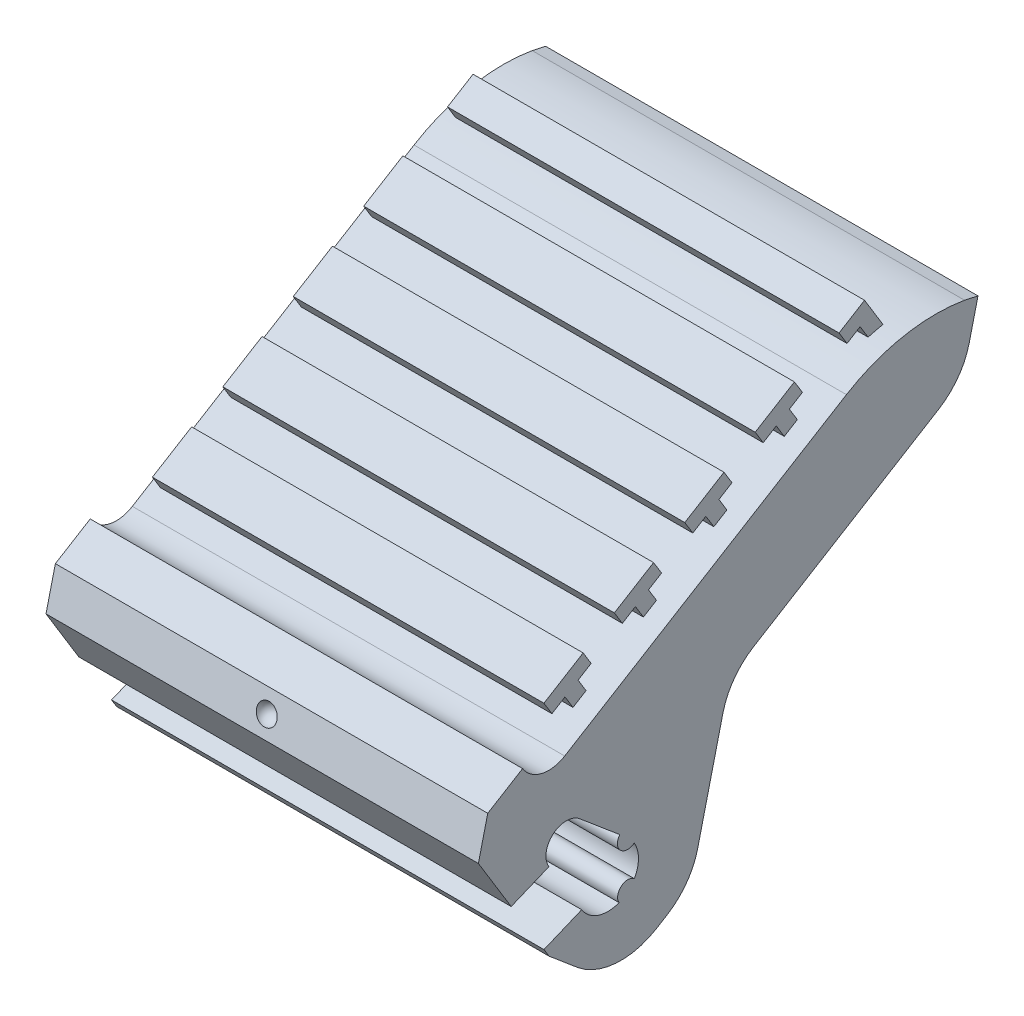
SolidWorks part; units mm, degrees
other "<finger_flexure_print>-<Pulley Cover Fillet>"
ref_plane "Front Plane" through (0, 0, 0) normal (0, 0, 1) x (1, 0, 0)
ref_plane "Top Plane" through (0, 0, 0) normal (0, 1, 0) x (1, 0, 0)
ref_plane "Right Plane" through (0, 0, 0) normal (1, 0, 0) x (0, 0, -1)
inserted part "finger_flexure_print"
sketch "Sketch1" plane through (15.875, 0, 0) normal (1, 0, 0) x (0, 0, -1)
  line L5 (81.6646, 21.8297) -> (84.81, 16.6812)
  line L7 (82.2755, 29.2145) -> (110.3269, 46.3519)
  line L8 (115.3247, 43.1358) -> (116.3122, 42.9188)
  line L10 (-14.375, -14.1005) -> (-11.375, -14.1005) construction
  line L11 (-11.375, 2.75) -> (-10.375, 2.75)
  line L12 (-1.7843, 6.8) -> (-0.3647, 6.8)
  line L15 (-15.375, -17.1005) -> (-15.375, -15.1005) construction
  line L16 (-15.375, -17.1005) -> (-14.375, -17.1005) construction
  line L17 (-14.375, -14.1005) -> (-11.375, -14.1005)
  line L18 (-11.375, -14.1005) -> (-10.375, -15.1005)
  line L19 (-10.375, -15.1005) -> (-10.375, 2.75)
  line L20 (-10.375, 2.75) -> (-11.375, 2.75)
  line L21 (-11.375, 2.75) -> (-11.375, -14.1005)
  line L25 (-11.375, 2.75) -> (-11.375, -14.1005)
  line L26 (-15.375, -17.1005) -> (-15.375, -15.1005)
  line L27 (-15.375, -17.1005) -> (-14.375, -17.1005)
  line L28 (20.625, -14.1005) -> (23.625, -14.1005) construction
  line L29 (24.625, -15.1005) -> (24.625, -17.1005) construction
  line L30 (23.625, -17.1005) -> (24.625, -17.1005) construction
  line L31 (20.625, -14.1005) -> (23.625, -14.1005)
  line L32 (24.625, -15.1005) -> (24.625, -17.1005)
  line L33 (23.625, -17.1005) -> (24.625, -17.1005)
  line L41 (-14.375, -17.1005) -> (23.625, -17.1005)
  line L42 (23.625, -17.1005) -> (23.625, -15.1005)
  line L43 (23.625, -15.1005) -> (20.625, -15.1005)
  line L44 (20.625, -15.1005) -> (20.625, -11.6505)
  line L45 (14.375, -5.4005) -> (12.375, -5.4005)
  line L46 (11.375, -4.4005) -> (11.375, -2.4005)
  line L47 (11.375, -2.4005) -> (23.8936, -0.7524)
  line L48 (23.8936, -0.7524) -> (26.5211, -3.8884)
  line L49 (31.6478, -5.507) -> (31.8116, -5.4631)
  line L50 (34.8476, -3.1335) -> (38.8636, 3.8225)
  line L51 (41.8997, 6.1521) -> (53.7261, 9.321)
  line L52 (57.5202, 8.8215) -> (64.4762, 4.8055)
  line L53 (68.2703, 4.306) -> (69.0649, 4.5189)
  line L54 (72.7614, 9.0414) -> (72.9287, 11.7598)
  line L55 (72.9287, 11.7598) -> (84.81, 16.6812)
  line L56 (84.81, 16.6812) -> (86.8789, 14.9378)
  line L57 (92.7076, 14.4944) -> (93.4693, 14.9598)
  line L58 (95.7229, 18.0527) -> (97.5841, 25.7589)
  line L59 (99.8376, 28.8518) -> (113.4109, 37.1441)
  line L60 (115.6645, 40.237) -> (116.3122, 42.9188)
  line L61 (103.94, 45.9069) -> (83.2549, 33.2698)
  line L62 (82.2755, 29.2145) -> (80.3127, 28.0154)
  line L63 (80.3127, 28.0154) -> (79.6251, 25.1682)
  line L64 (79.6251, 25.1682) -> (81.6646, 21.8297)
  line L65 (81.6646, 21.8297) -> (71.3728, 17.5667)
  line L66 (71.3728, 17.5667) -> (71.0449, 18.7904)
  line L67 (71.0449, 18.7904) -> (65.2552, 22.1331)
  line L68 (65.2552, 22.1331) -> (63.0336, 21.5378)
  line L69 (59.4206, 23.6238) -> (29.8167, 15.6914)
  line L70 (27.7307, 12.0784) -> (25.5091, 11.4831)
  line L71 (25.5091, 11.4831) -> (22.1665, 5.6935)
  line L72 (22.1665, 5.6935) -> (22.651, 3.8851)
  line L73 (22.651, 3.8851) -> (11.375, 2.4005)
  line L74 (11.375, 2.4005) -> (11.375, 4.2728)
  line L75 (11.375, 4.2728) -> (8.8478, 6.8)
  line L76 (8.8478, 6.8) -> (-1.7843, 6.8)
  line L77 (-10.375, 2.75) -> (-10.375, -15.1005)
  line L78 (-10.375, -15.1005) -> (-14.375, -15.1005)
  line L79 (-14.375, -15.1005) -> (-14.375, -17.1005)
  line L80 (-14.375, -17.1005) -> (23.625, -17.1005)
  line L83 (20.625, -14.1005) -> (20.625, -11.6505)
  line L84 (14.375, -5.4005) -> (12.375, -5.4005)
  line L85 (11.375, -4.4005) -> (11.375, -2.4005)
  line L86 (11.375, -2.4005) -> (23.8936, -0.7524)
  line L87 (23.8936, -0.7524) -> (26.5211, -3.8884)
  line L88 (31.6478, -5.507) -> (31.8116, -5.4631)
  line L89 (34.8476, -3.1335) -> (38.8636, 3.8225)
  line L90 (41.8997, 6.1521) -> (53.7261, 9.321)
  line L91 (57.5202, 8.8215) -> (64.4762, 4.8055)
  line L92 (68.2703, 4.306) -> (69.0649, 4.5189)
  line L93 (72.7614, 9.0414) -> (72.9287, 11.7598)
  line L94 (72.9287, 11.7598) -> (84.81, 16.6812)
  line L95 (84.81, 16.6812) -> (86.8789, 14.9378)
  line L96 (92.7076, 14.4944) -> (93.4693, 14.9598)
  line L97 (95.7229, 18.0527) -> (97.5841, 25.7589)
  line L98 (99.8376, 28.8518) -> (113.4109, 37.1441)
  line L99 (115.6645, 40.237) -> (116.3122, 42.9188)
  line L100 (103.94, 45.9069) -> (83.2549, 33.2698)
  line L101 (82.2755, 29.2145) -> (80.3127, 28.0154)
  line L102 (80.3127, 28.0154) -> (79.6251, 25.1682)
  line L103 (79.6251, 25.1682) -> (81.6646, 21.8297)
  line L104 (81.6646, 21.8297) -> (71.3728, 17.5667)
  line L105 (71.3728, 17.5667) -> (71.0449, 18.7904)
  line L106 (71.0449, 18.7904) -> (65.2552, 22.1331)
  line L107 (65.2552, 22.1331) -> (63.0336, 21.5378)
  line L108 (59.4206, 23.6238) -> (29.8167, 15.6914)
  line L109 (27.7307, 12.0784) -> (25.5091, 11.4831)
  line L110 (25.5091, 11.4831) -> (22.1665, 5.6935)
  line L111 (22.1665, 5.6935) -> (22.651, 3.8851)
  line L112 (22.651, 3.8851) -> (11.375, 2.4005)
  line L113 (11.375, 2.4005) -> (11.375, 4.2728)
  line L114 (11.375, 4.2728) -> (8.8478, 6.8)
  line L115 (8.8478, 6.8) -> (-0.3647, 6.8)
  arc A2 (115.3247, 43.1358) -> (104.305, 45.3096) centre (108.632, 38.2267) ccw construction
  arc A3 (115.3247, 43.1358) -> (110.3269, 46.3519) centre (108.632, 38.2267) ccw
  arc A7 (-14.375, -14.1005) -> (-15.375, -15.1005) centre (-14.375, -15.1005) ccw construction
  arc A8 (-14.375, -14.1005) -> (-15.375, -15.1005) centre (-14.375, -15.1005) ccw
  arc A9 (-1.7843, 6.8) -> (-10.375, 2.75) centre (-5.125, 2.75) ccw
  arc A10 (-0.3647, 6.8) -> (-11.375, 2.75) centre (-5.125, 2.75) ccw
  arc A12 (-0.3647, 6.8) -> (-11.375, 2.75) centre (-5.125, 2.75) ccw
  arc A13 (24.625, -15.1005) -> (23.625, -14.1005) centre (23.625, -15.1005) ccw construction
  arc A14 (24.625, -15.1005) -> (23.625, -14.1005) centre (23.625, -15.1005) ccw
  arc A21 (20.625, -11.6505) -> (14.375, -5.4005) centre (14.375, -11.6505) ccw
  arc A22 (11.375, -4.4005) -> (12.375, -5.4005) centre (12.375, -4.4005) ccw
  arc A23 (26.5211, -3.8884) -> (31.6478, -5.507) centre (30.3537, -0.6773) ccw
  arc A24 (31.8116, -5.4631) -> (34.8476, -3.1335) centre (30.5175, -0.6335) ccw
  arc A25 (41.8997, 6.1521) -> (38.8636, 3.8225) centre (43.1937, 1.3225) ccw
  arc A26 (57.5202, 8.8215) -> (53.7261, 9.321) centre (55.0202, 4.4914) ccw
  arc A27 (64.4762, 4.8055) -> (68.2703, 4.306) centre (66.9762, 9.1356) ccw
  arc A28 (69.0649, 4.5189) -> (72.7614, 9.0414) centre (67.7708, 9.3485) ccw
  arc A29 (86.8789, 14.9378) -> (92.7076, 14.4944) centre (90.1009, 18.7612) ccw
  arc A30 (93.4693, 14.9598) -> (95.7229, 18.0527) centre (90.8626, 19.2265) ccw
  arc A31 (99.8376, 28.8518) -> (97.5841, 25.7589) centre (102.4443, 24.5851) ccw
  arc A32 (113.4109, 37.1441) -> (115.6645, 40.237) centre (110.8043, 41.4109) ccw
  arc A33 (116.3122, 42.9188) -> (103.94, 45.9069) centre (108.632, 38.2267) ccw
  arc A34 (83.2549, 33.2698) -> (82.2755, 29.2145) centre (84.7928, 30.7524) ccw
  arc A35 (63.0336, 21.5378) -> (59.4206, 23.6238) centre (60.1841, 20.7743) ccw
  arc A36 (29.8167, 15.6914) -> (27.7307, 12.0784) centre (30.5802, 12.8419) ccw
  arc A37 (-1.7843, 6.8) -> (-10.375, 2.75) centre (-5.125, 2.75) ccw
  arc A38 (20.625, -11.6505) -> (14.375, -5.4005) centre (14.375, -11.6505) ccw
  arc A39 (11.375, -4.4005) -> (12.375, -5.4005) centre (12.375, -4.4005) ccw
  arc A40 (26.5211, -3.8884) -> (31.6478, -5.507) centre (30.3537, -0.6773) ccw
  arc A41 (31.8116, -5.4631) -> (34.8476, -3.1335) centre (30.5175, -0.6335) ccw
  arc A42 (41.8997, 6.1521) -> (38.8636, 3.8225) centre (43.1937, 1.3225) ccw
  arc A43 (57.5202, 8.8215) -> (53.7261, 9.321) centre (55.0202, 4.4914) ccw
  arc A44 (64.4762, 4.8055) -> (68.2703, 4.306) centre (66.9762, 9.1356) ccw
  arc A45 (69.0649, 4.5189) -> (72.7614, 9.0414) centre (67.7708, 9.3485) ccw
  arc A46 (86.8789, 14.9378) -> (92.7076, 14.4944) centre (90.1009, 18.7612) ccw
  arc A47 (93.4693, 14.9598) -> (95.7229, 18.0527) centre (90.8626, 19.2265) ccw
  arc A48 (99.8376, 28.8518) -> (97.5841, 25.7589) centre (102.4443, 24.5851) ccw
  arc A49 (113.4109, 37.1441) -> (115.6645, 40.237) centre (110.8043, 41.4109) ccw
  arc A50 (116.3122, 42.9188) -> (103.94, 45.9069) centre (108.632, 38.2267) ccw
  arc A51 (83.2549, 33.2698) -> (82.2755, 29.2145) centre (84.7928, 30.7524) ccw
  arc A52 (63.0336, 21.5378) -> (59.4206, 23.6238) centre (60.1841, 20.7743) ccw
  arc A53 (29.8167, 15.6914) -> (27.7307, 12.0784) centre (30.5802, 12.8419) ccw
  dimension "D1" = 0
  dimension "D2" = 0
  dimension "D3" = 0
extrude "Piece Cut" cut sketch "Sketch1" against normal through all contours L108 A53 L109 L110 L111 L112 L113 L114 L115 A12 L25 L17 A8 L26 L27 L80 L33 L32 A14 L31 L83 A38 L84 A39 L85 L86 L87 A40 L88 A41 L89 A42 L90 A43 L91 A44 L92 A45 L93 L94 L5 L104 L105 L106 L107 A52 | L100 A51 L7 A3 L8 A50
ref_point "Ref Center"
